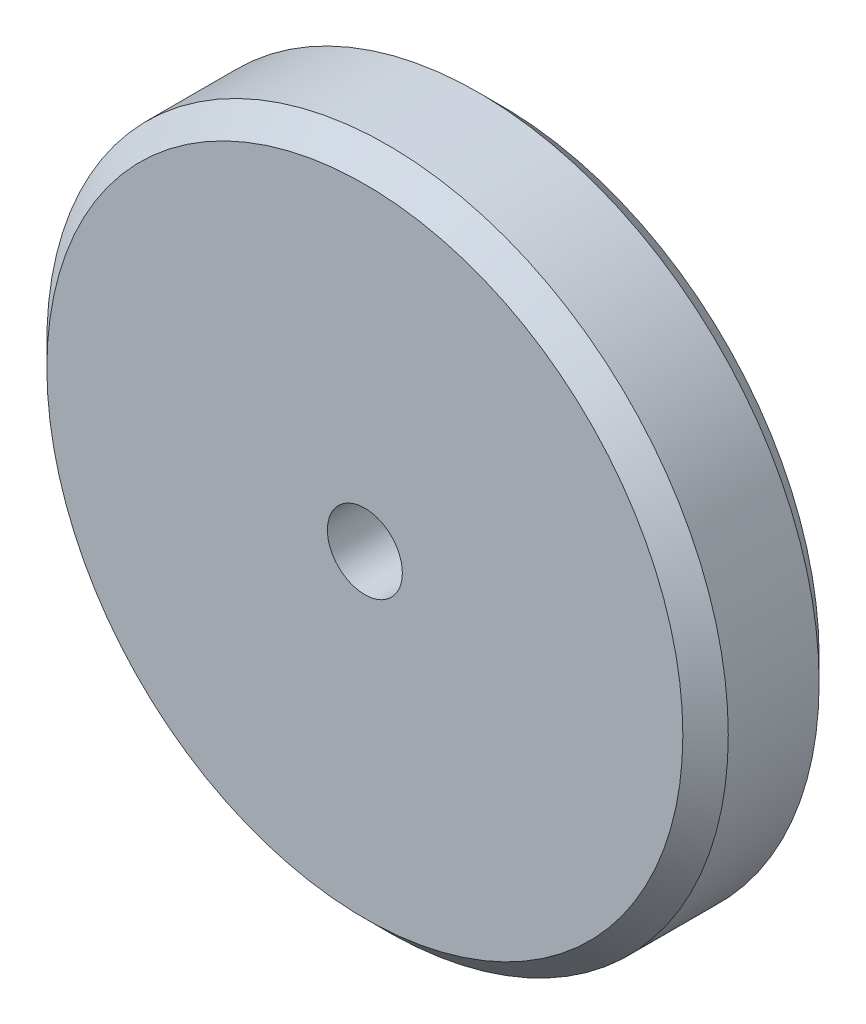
SolidWorks part; units mm, degrees
ref_plane "Front Plane" through (0, 0, 0) normal (0, 0, 1) x (1, 0, 0)
ref_plane "Top Plane" through (0, 0, 0) normal (0, 1, 0) x (1, 0, 0)
ref_plane "Right Plane" through (0, 0, 0) normal (1, 0, 0) x (0, 0, -1)
sketch "Sketch1" plane through (0, 0, 0) normal (0, 0, 1) x (1, 0, 0)
  circle A0 centre (0, 0) radius 15
  dimension "D1" = 30
extrude "Extrude1" add sketch "Sketch1" along normal blind 6
hole_wizard "M4 Tapped Hole1" positions "3DSketch1" profile "Sketch3" tap size "M4" standard "ISO"
sketch3d "3DSketch1"
  line L0 (0, 0, 6) -> (0, 0, 0) construction
  point P0 (0, 0, 6)
sketch "Sketch3" plane through (0, 0, 6) normal (1, 0, 0) x (0, -1, 0)
  line L0 (0, 0) -> (0, 6)
  line L1 (0, 6) -> (1.65, 6)
  line L2 (1.65, 6) -> (1.65, 0)
  line L5 (1.65, 0) -> (0, 0)
  line L11 (0, -6.35) -> (0, 107.95) construction
  dimension "Thru Tap Drill Dia." = 3.3
  dimension "Thru Tap Drill Depth" = 6
chamfer "Chamfer1" distance 1 angle 45 2 edges at (15, 0, 0) (15, 0, 6)
